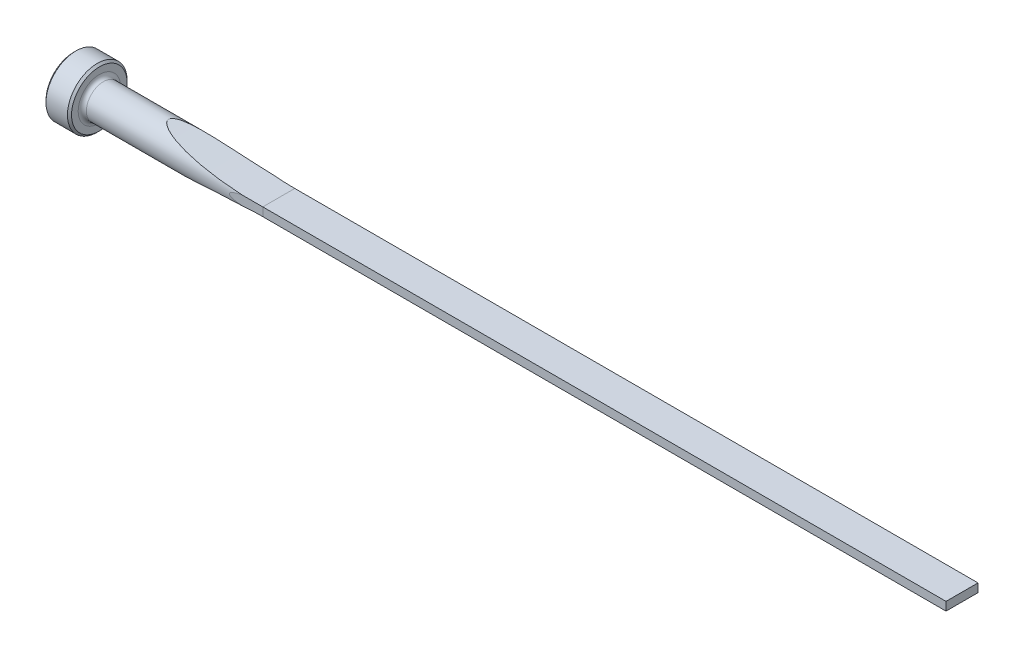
SolidWorks part; units mm, degrees
ref_plane "Front Plane" through (0, 0, 0) normal (0, 0, 1) x (1, 0, 0)
ref_plane "Top Plane" through (0, 0, 0) normal (0, 1, 0) x (1, 0, 0)
ref_plane "Right Plane" through (0, 0, 0) normal (1, 0, 0) x (0, 0, -1)
sketch "Sketch1" plane through (0, 0, 0) normal (0, 0, 1) x (1, 0, 0)
  line L0 (0, 0) -> (175.5286, 0) construction
  line L1 (0, 0) -> (0, 5.5499)
  line L2 (0, 5.5499) -> (4.7498, 5.5499)
  line L3 (4.7498, 5.5499) -> (4.7498, 3.175)
  line L4 (4.7498, 3.175) -> (165.1, 3.175)
  line L5 (165.1, 3.175) -> (165.1, 0)
  line L6 (165.1, 0) -> (0, 0)
  dimension "D1" = 165.1
  dimension "D2" = 11.0998
  dimension "D3" = 6.35
  dimension "D4" = 4.7498
revolve "Revolve1" add sketch "Sketch1" angle 360 about L0
sketch "Sketch2" plane through (0, 0, 0) normal (0, 0, 1) x (1, 0, 0)
  line L0 (165.1, 3.175) -> (165.1, 0.7874)
  line L1 (165.1, -3.175) -> (165.1, 3.175) construction
  line L2 (165.1, 0.7874) -> (38.1, 0.7874)
  line L3 (165.1, 3.175) -> (4.7498, 3.175) construction
  line L4 (17.635, 3.175) -> (165.1, 3.175)
  line L5 (166.0833, 0) -> (153.1705, 0) construction
  arc A0 (38.1, 0.7874) -> (17.635, 3.175) centre (38.1, 89.6874) cw
  dimension "D1" = 88.9
  dimension "D3" = 127
  dimension "D2" = 1.5748
  dimension "D4" = 20.465
extrude "Cut-Extrude1" cut sketch "Sketch2" against normal through all both and the other way through all
mirror "Mirror1" about plane through (0, 0, 0) normal (0, 1, 0) of "Cut-Extrude1"
sketch "Sketch3" plane through (0, 0, 0) normal (0, 1, 0) x (1, 0, 0)
  line L0 (165.1, 3.175) -> (165.1, 2.9718)
  line L1 (165.1, 3.0758) -> (165.1, -3.0758) construction
  line L2 (165.1, 2.9718) -> (38.1, 2.9718)
  line L3 (165.1, 3.175) -> (4.7498, 3.175) construction
  line L4 (32.0927, 3.175) -> (165.1, 3.175)
  line L5 (163.4716, 0) -> (166.2513, 0) construction
  line L6 (38.1, 3.0758) -> (38.1, -3.0758) construction
  arc A0 (38.1, 2.9718) -> (32.0927, 3.175) centre (38.1, 91.8718) cw
  dimension "D2" = 88.9
  dimension "D1" = 5.9436
extrude "Cut-Extrude2" cut sketch "Sketch3" against normal through all both and the other way through all
mirror "Mirror2" about plane through (0, 0, 0) normal (0, 0, 1) of "Cut-Extrude2"
fillet "Fillet1" radius 0.762 1 edges at (4.7498, 0, 3.175)
chamfer "Chamfer1" distance 0.381 angle 45 2 edges at (0, 0, 5.5499) (4.7498, 0, 5.5499)
